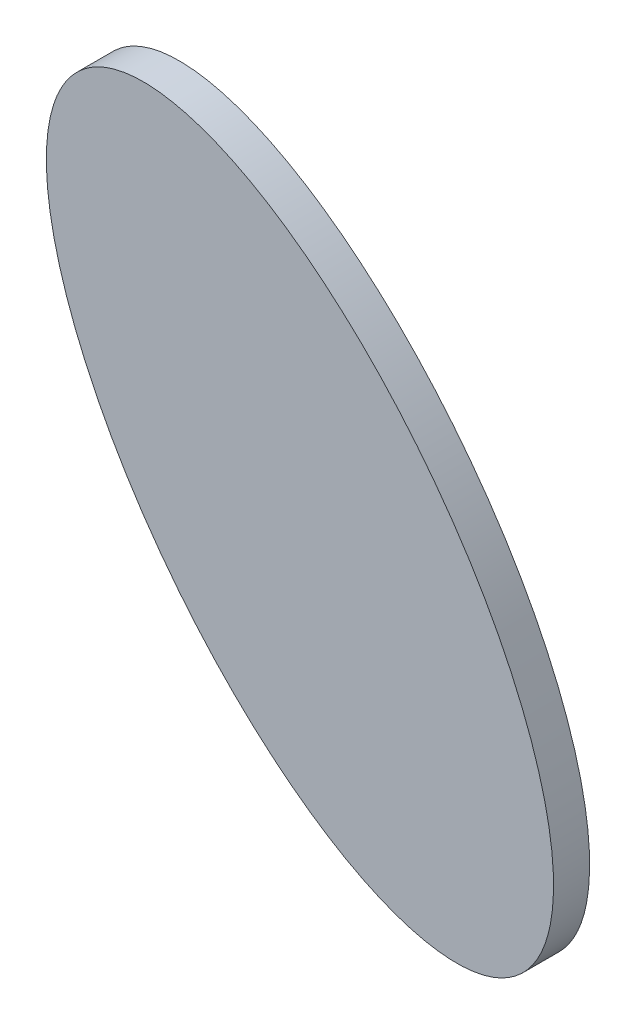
SolidWorks part; units mm, degrees
ref_plane "Plan de face" through (0, 0, 0) normal (0, 0, 1) x (1, 0, 0)
ref_plane "Plan de dessus" through (0, 0, 0) normal (0, 1, 0) x (1, 0, 0)
ref_plane "Plan de droite" through (0, 0, 0) normal (1, 0, 0) x (0, 0, -1)
sketch "Esquisse2" plane through (0, 0, 0) normal (0, 0, 1) x (1, 0, 0)
  ellipse E0 centre (0, 0) end of major axis (475.2559, -633.5) minor radius 375
  dimension "D1" = 750
  dimension "D2" = 1267
extrude "Boss.-Extru.1" add sketch "Esquisse2" along normal blind 80 contours E0
